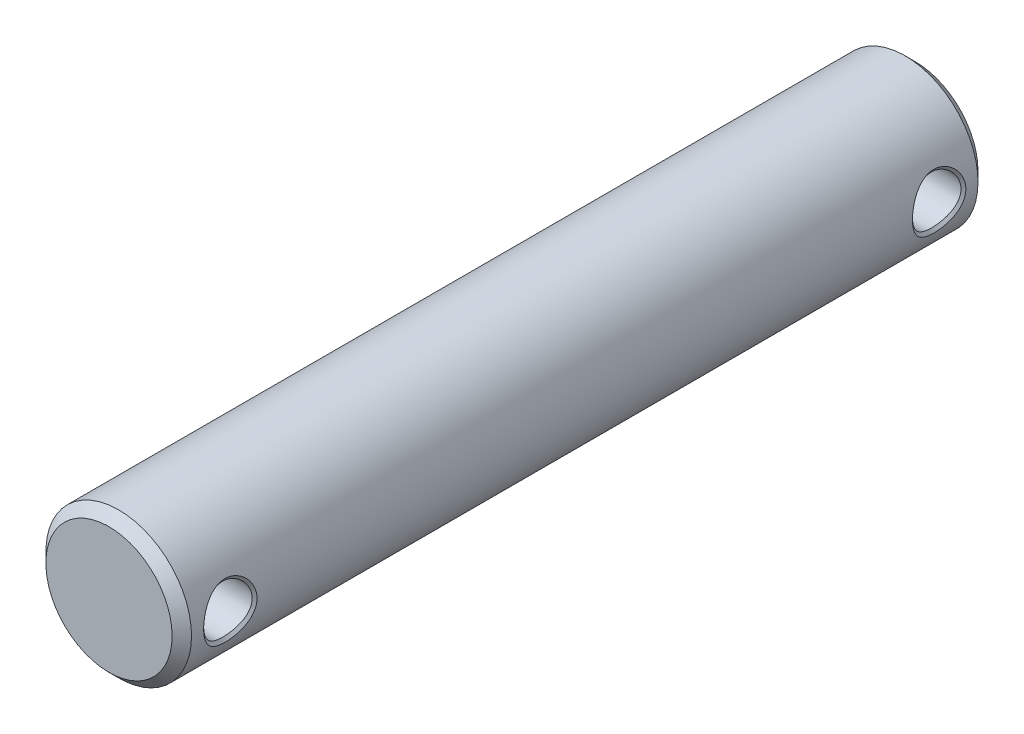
SolidWorks part; units mm, degrees
ref_plane "Plan de face" through (0, 0, 0) normal (0, 0, 1) x (1, 0, 0)
ref_plane "Plan de dessus" through (0, 0, 0) normal (0, 1, 0) x (1, 0, 0)
ref_plane "Plan de droite" through (0, 0, 0) normal (1, 0, 0) x (0, 0, -1)
sketch "Esquisse1" plane through (0, 0, 0) normal (0, 0, 1) x (1, 0, 0)
  circle A0 centre (0, 0) radius 15
  dimension "D1" = 30
extrude "Extrusion1" add sketch "Esquisse1" along normal blind 166
chamfer "Chanfrein1" distance 2 angle 45 2 edges at (15, 0, 166) (15, 0, 0)
sketch "Esquisse2" plane through (0, 0, 0) normal (1, 0, 0) x (0, 0, -1)
  line L0 (-166, 13) -> (-166, -13) construction
  line L1 (0, -13) -> (0, 13) construction
  circle A0 centre (-156, 0) radius 5
  circle A1 centre (-10, 0) radius 5
  dimension "D1" = 10
  dimension "D3" = 10
  dimension "D2" = 10
extrude "Enlèv. mat.-Extru.1" cut sketch "Esquisse2" against normal mid plane 166
chamfer "Chanfrein2" distance 0.5 angle 45 4 edges at (-14.9759, 0.8497, 151.0727) (14.9759, 0.8497, 160.9273) (-14.9759, 0.8497, 5.0727) (14.9759, 0.8497, 14.9273)
